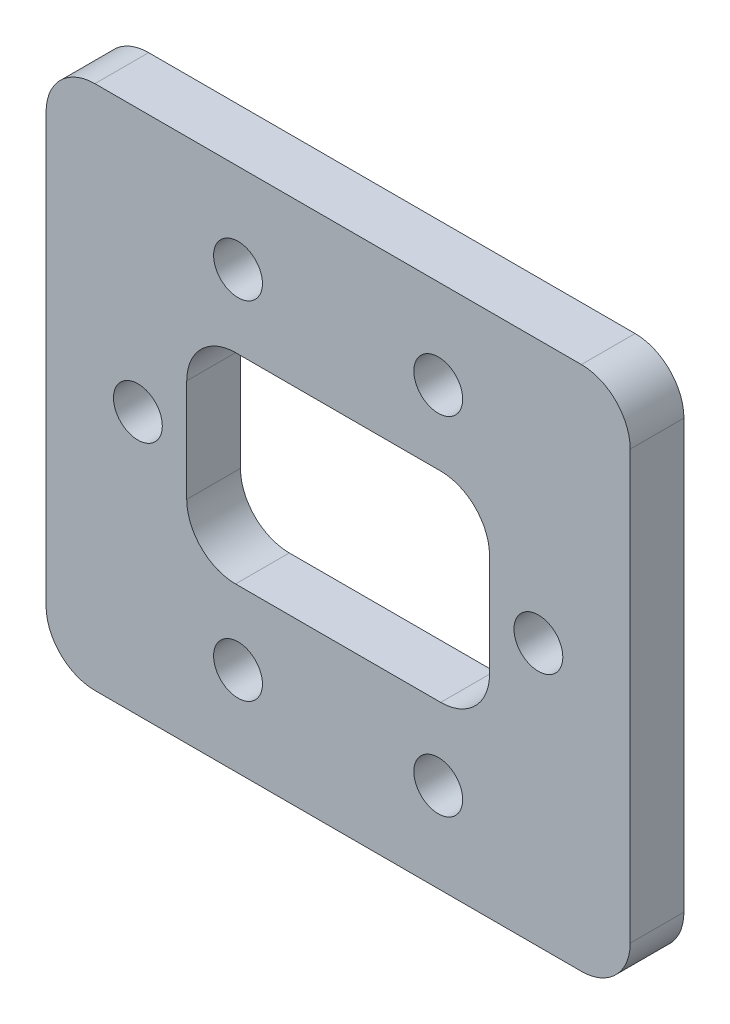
SolidWorks part; units mm, degrees
ref_plane "前基準面" through (0, 0, 0) normal (0, 0, 1) x (1, 0, 0)
ref_plane "上基準面" through (0, 0, 0) normal (0, 1, 0) x (1, 0, 0)
ref_plane "右基準面" through (0, 0, 0) normal (1, 0, 0) x (0, 0, -1)
sketch "草圖1" plane through (0, 0, 0) normal (0, 0, 1) x (1, 0, 0)
  line L0 (-28.8779, 27.6748) -> (30.9221, 27.6748)
  line L1 (-9.4779, 11.0283) -> (11.5221, 11.0283)
  line L2 (-14.4779, 6.0283) -> (-14.4779, -4.4788)
  line L3 (-9.4779, -9.4788) -> (11.5221, -9.4788)
  line L4 (16.5221, 6.0283) -> (16.5221, -4.4788)
  line L5 (-14.4779, 11.0283) -> (16.5221, -9.4788) construction
  line L6 (-14.4779, -9.4788) -> (16.5221, 11.0283) construction
  line L7 (-14.4779, 26.0283) -> (16.5221, 26.0283)
  line L8 (-24.4779, 16.0283) -> (-24.4779, -14.4788)
  line L9 (-14.4779, -24.4788) -> (16.5221, -24.4788)
  line L10 (26.5221, 16.0283) -> (26.5221, -14.4788)
  line L11 (-24.4779, 26.0283) -> (26.5221, -24.4788) construction
  line L12 (-24.4779, -24.4788) -> (26.5221, 26.0283) construction
  line L14 (-36.9779, 30.7748) -> (39.0221, -29.2252) construction
  line L15 (-36.9779, -29.2252) -> (39.0221, 30.7748) construction
  line L16 (-33.8779, 22.6748) -> (-33.8779, -21.1252)
  line L17 (-28.8779, -26.1252) -> (30.9221, -26.1252)
  line L18 (35.9221, 22.6748) -> (35.9221, -21.1252)
  circle A0 centre (1.0221, 0.7748) radius 0.353 construction
  circle A1 centre (21.5221, 0.7748) radius 2.5
  circle A2 centre (-19.4779, 0.7748) radius 2.5
  arc A3 (-24.4779, -14.4788) -> (-14.4779, -24.4788) centre (-14.4779, -14.4788) ccw
  arc A4 (16.5221, -24.4788) -> (26.5221, -14.4788) centre (16.5221, -14.4788) ccw
  arc A5 (16.5221, 26.0283) -> (26.5221, 16.0283) centre (16.5221, 16.0283) cw
  arc A6 (-14.4779, 26.0283) -> (-24.4779, 16.0283) centre (-14.4779, 16.0283) ccw
  arc A7 (-9.4779, 11.0283) -> (-14.4779, 6.0283) centre (-9.4779, 6.0283) ccw
  arc A8 (-14.4779, -4.4788) -> (-9.4779, -9.4788) centre (-9.4779, -4.4788) ccw
  arc A9 (11.5221, -9.4788) -> (16.5221, -4.4788) centre (11.5221, -4.4788) ccw
  arc A10 (11.5221, 11.0283) -> (16.5221, 6.0283) centre (11.5221, 6.0283) cw
  arc A11 (-33.8779, -21.1252) -> (-28.8779, -26.1252) centre (-28.8779, -21.1252) ccw
  arc A12 (30.9221, -26.1252) -> (35.9221, -21.1252) centre (30.9221, -21.1252) ccw
  arc A13 (35.9221, 22.6748) -> (30.9221, 27.6748) centre (30.9221, 22.6748) ccw
  arc A14 (-28.8779, 27.6748) -> (-33.8779, 22.6748) centre (-28.8779, 22.6748) ccw
  circle A15 centre (11.2721, 18.5283) radius 2.5
  circle A16 centre (11.2721, -16.9788) radius 2.5
  circle A17 centre (-9.2279, -16.9788) radius 2.5
  circle A18 centre (-9.2279, 18.5283) radius 2.5
  point P8 (1.0221, 0.7748)
  point P13 (1.0221, 0.7748)
  point P15 (1.0221, 0.7748)
  point P65 (1.0221, 0.7748)
  dimension "D1" = 0.706
  dimension "D2" = 5
  dimension "D4" = 5
  dimension "D7" = 10
  dimension "D8" = 5
  dimension "D9" = 5
  dimension "D12" = 5
  dimension "D11" = 5
  dimension "D17" = 5
  dimension "D18" = 5
  dimension "D19" = 5
  dimension "D3" = 20.5
  dimension "D5" = 20.5
  dimension "D6" = 5
  dimension "D10" = 5
  dimension "D13" = 7.5
  dimension "D14" = 7.5
  dimension "D15" = 17.7535
  dimension "D16" = 20.5
extrude "填料-伸長1" add sketch "草圖1" along normal blind 5.5 contours L0 A14 L16 A11 L17 A12 L18 A13 A6 L7 A5 L10 A4 L9 A3 L8 | L7 A6 L8 A3 L9 A4 L10 A5 A18 A17 A16 A15 A1 A2 L1 A10 L4 A9 L3 A8 L2 A7
sketch "草圖24" plane through (0, 0, 5.5) normal (0, 0, 1) x (1, 0, 0)
  line L0 (-28.8779, 22.6748) -> (-28.8779, -21.1252)
  line L1 (-23.8779, 27.6748) -> (25.9221, 27.6748)
  line L2 (-23.8779, -26.1252) -> (25.9221, -26.1252)
  line L3 (30.9221, 22.6748) -> (30.9221, -21.1252)
  line L4 (30.9221, 27.6748) -> (-28.8779, 27.6748)
  line L5 (-33.8779, 22.6748) -> (-33.8779, -21.1252)
  line L6 (-28.8779, -26.1252) -> (30.9221, -26.1252)
  line L7 (35.9221, -21.1252) -> (35.9221, 22.6748)
  line L8 (30.9221, 27.6748) -> (-28.8779, 27.6748)
  line L9 (-33.8779, 22.6748) -> (-33.8779, -21.1252)
  line L10 (-28.8779, -26.1252) -> (30.9221, -26.1252)
  line L11 (35.9221, -21.1252) -> (35.9221, 22.6748)
  arc A0 (-28.8779, -21.1252) -> (-23.8779, -26.1252) centre (-23.8779, -21.1252) ccw
  arc A1 (-28.8779, 22.6748) -> (-23.8779, 27.6748) centre (-23.8779, 22.6748) cw
  arc A2 (30.9221, 22.6748) -> (25.9221, 27.6748) centre (25.9221, 22.6748) ccw
  arc A3 (30.9221, -21.1252) -> (25.9221, -26.1252) centre (25.9221, -21.1252) cw
  arc A4 (-28.8779, 27.6748) -> (-33.8779, 22.6748) centre (-28.8779, 22.6748) ccw
  arc A5 (-33.8779, -21.1252) -> (-28.8779, -26.1252) centre (-28.8779, -21.1252) ccw
  arc A6 (30.9221, -26.1252) -> (35.9221, -21.1252) centre (30.9221, -21.1252) ccw
  arc A7 (35.9221, 22.6748) -> (30.9221, 27.6748) centre (30.9221, 22.6748) ccw
  arc A8 (-28.8779, 27.6748) -> (-33.8779, 22.6748) centre (-28.8779, 22.6748) ccw
  arc A9 (-33.8779, -21.1252) -> (-28.8779, -26.1252) centre (-28.8779, -21.1252) ccw
  arc A10 (30.9221, -26.1252) -> (35.9221, -21.1252) centre (30.9221, -21.1252) ccw
  arc A11 (35.9221, 22.6748) -> (30.9221, 27.6748) centre (30.9221, 22.6748) ccw
  point P15 (1.0221, 27.6748)
  point P26 (1.0221, -26.1252)
  point P27 (1.0221, -26.1252)
  point P28 (1.0221, 27.6748)
  dimension "D1" = 0
extrude "除料-伸長1" cut sketch "草圖24" against normal blind 10 contours L0 A1 A0 M9 M10 M11 M12 M13 | L3 A3 A2 M13 M14 M15 M16 M9
